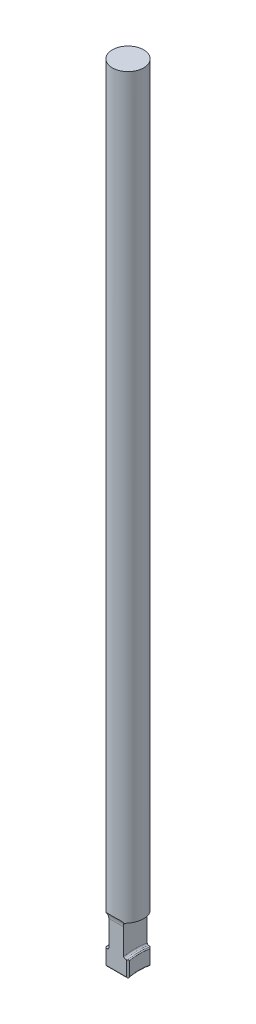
SolidWorks part; units mm, degrees
ref_plane "Front Plane" through (0, 0, 0) normal (0, 0, 1) x (1, 0, 0)
ref_plane "Top Plane" through (0, 0, 0) normal (0, 1, 0) x (1, 0, 0)
ref_plane "Right Plane" through (0, 0, 0) normal (1, 0, 0) x (0, 0, -1)
sketch "Sketch1" plane through (0, 0, 0) normal (1, 0, 0) x (0, 0, -1)
  line L0 (-5.588, 212) -> (-5.588, 0)
  line L1 (0, 249.2329) -> (0, 0) construction
  line L2 (5.588, 212) -> (5.588, 0)
  line L3 (-5.588, 212) -> (5.588, 212)
  line L6 (-5.588, 0) -> (5.588, 0)
  arc A0 (-12, 0) -> (12, 0) centre (0, 0) cw construction
  dimension "R" = 12
  dimension "L" = 200
  dimension "T" = 11.176
extrude "Boss-Extrude1" add sketch "Sketch1" along normal mid plane 11.176
sketch "Sketch8" plane through (0, 0, 0) normal (1, 0, 0) x (0, 0, -1)
  circle A0 centre (0, 0) radius 12
  arc A1 (12, 0) -> (-12, 0) centre (0, 0) ccw construction
extrude "Cut-Extrude4" cut sketch "Sketch8" against normal through all both and the other way through all
sketch "Sketch2" plane through (0, 0, 0) normal (0, 0, 1) x (1, 0, 0)
  line L0 (5.588, 16) -> (1.905, 16)
  line L1 (5.588, 212) -> (5.588, 10.6195) construction
  line L2 (1.905, 16) -> (1.905, 24)
  line L3 (1.905, 24) -> (5.588, 24)
  line L4 (5.588, 24) -> (5.588, 16)
  line L5 (0, 29.9173) -> (0, 0) construction
  line L6 (-5.588, 24) -> (-5.588, 16)
  line L7 (-1.905, 24) -> (-5.588, 24)
  line L8 (-1.905, 16) -> (-1.905, 24)
  line L9 (-5.588, 16) -> (-1.905, 16)
  line L10 (-8.8482, 0) -> (24.5305, 0) construction
  dimension "D1" = 3.81
  dimension "D2" = 24
  dimension "D3" = 16
revolve "Cut-Revolve1" cut sketch "Sketch2" angle 360 about L10
sketch "Sketch6" plane through (0, 0, 0) normal (1, 0, 0) x (0, 0, -1)
  line L0 (0, 19.903) -> (0, 0) construction
  line L1 (3, 0) -> (22.05, 0)
  line L2 (3, 0) -> (3, 22.6124)
  line L3 (5.3876, 25) -> (22.05, 25)
  line L4 (22.05, 0) -> (22.05, 25)
  line L9 (-3, 0) -> (-22.05, 0)
  line L10 (-22.05, 0) -> (-22.05, 25)
  line L11 (-5.3876, 25) -> (-22.05, 25)
  line L12 (-3, 0) -> (-3, 22.6124)
  arc A0 (3, 22.6124) -> (5.3876, 25) centre (5.3876, 22.6124) cw
  arc A1 (-3, 22.6124) -> (-5.3876, 25) centre (-5.3876, 22.6124) ccw
  dimension "D3" = 2.3876
  dimension "D1" = 25
  dimension "MT" = 6
  dimension "D2" = 19.05
extrude "Cut-Extrude2" cut sketch "Sketch6" against normal through all both and the other way through all
sketch "Sketch7" plane through (0, 0, 0) normal (0, 0, 1) x (1, 0, 0)
  line L6 (-5.588, 16) -> (-3, 16)
  line L8 (-5.588, 16) -> (-5.588, 0)
  line L9 (-5.588, 0) -> (-3, 0)
  line L10 (-3, 16) -> (-3, 0)
  line L11 (0, 16.5651) -> (0, 5.9342) construction
  line L12 (3, 16) -> (3, 0)
  line L13 (5.588, 0) -> (3, 0)
  line L14 (5.588, 16) -> (5.588, 0)
  line L15 (5.588, 16) -> (3, 16)
  dimension "MW" = 6
extrude "Cut-Extrude3" cut sketch "Sketch7" against normal through all both and the other way through all
fillet "Fillet1" radius 0.762 2 edges at (-1.905, 24, 0) (1.905, 24, 0)
fillet "Fillet2" radius 0.381 2 edges at (-1.905, 16, 0) (1.905, 16, 0)
fillet "Fillet3" radius 0.254 10 edges at (3, 13.6676, -3) (3, 13.6676, 3) (3, 16, 0) (-3, 13.6676, 3) (-3, 13.6676, -3) (-3, 16, 0) (3, 12, 0) (-3, 12, 0) (0, 11.619, -3) (0, 11.619, 3)
sketch "Sketch9" plane through (0, 212, 0) normal (0, 1, 0) x (1, 0, 0)
  circle A0 centre (0, 0) radius 4
  dimension "D1" = 8
extrude "Cut-Extrude5" cut sketch "Sketch9" against normal through all flip side to cut
